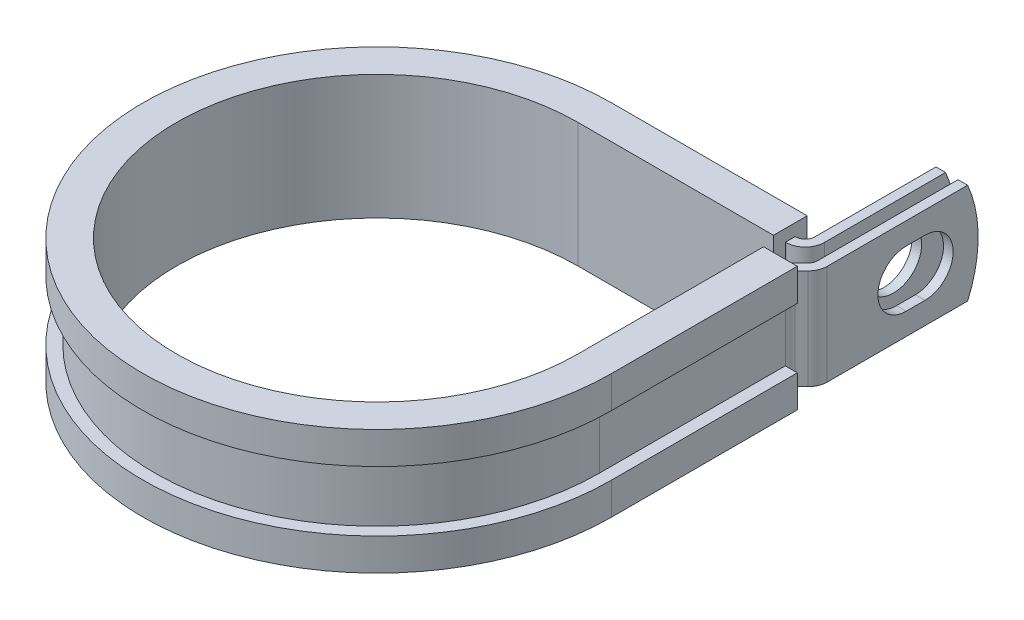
SolidWorks part; units mm, degrees
ref_plane "Front Plane" through (0, 0, 0) normal (0, 0, 1) x (1, 0, 0)
ref_plane "Top Plane" through (0, 0, 0) normal (0, 1, 0) x (1, 0, 0)
ref_plane "Right Plane" through (0, 0, 0) normal (1, 0, 0) x (0, 0, -1)
sketch "Sketch1" plane through (0, 0, 0) normal (0, 1, 0) x (1, 0, 0)
  line L0 (0, 26.924) -> (24.8083, 26.924)
  line L1 (26.924, 0) -> (26.924, 23.5115)
  line L2 (27.2467, 46.0248) -> (27.2467, 29.3624)
  line L3 (27.6382, 25.2357) -> (28.4644, 26.0619)
  line L5 (28.8215, 26.924) -> (28.8215, 46.0248)
  arc A0 (0, 26.924) -> (26.924, 0) centre (0, 0) ccw
  arc A1 (27.6382, 25.2357) -> (26.924, 23.5115) centre (29.3624, 23.5115) ccw
  arc A2 (28.4644, 26.0619) -> (28.8215, 26.924) centre (27.6023, 26.924) ccw
  arc A3 (24.8083, 26.924) -> (27.2467, 29.3624) centre (24.8083, 29.3624) ccw
extrude "Extrude-Thin1" add sketch "Sketch1" along normal mid plane 12.7 thin
sketch "Sketch2" plane through (26.0275, 0, 0) normal (-1, 0, 0) x (0, 0, 1)
  line L0 (-46.0248, 6.35) -> (-46.0248, -6.35) construction
  line L1 (0, 6.35) -> (0, -6.35) construction
  circle A0 centre (-38.1, 0) radius 3.5687
  point P2 (-46.0248, 0)
extrude "Cut-Extrude1" cut sketch "Sketch2" against normal up to surface (1.2192 mm away)
sketch "Sketch3" plane through (30.0407, 0, 0) normal (1, 0, 0) x (0, 0, -1)
  line L0 (36.9062, 0) -> (39.2938, 0) construction
  line L1 (36.9062, 3.5687) -> (39.2938, 3.5687)
  line L2 (36.9062, -3.5687) -> (39.2938, -3.5687)
  line L3 (46.0248, 6.35) -> (46.0248, -6.35) construction
  arc A0 (36.9062, 3.5687) -> (36.9062, -3.5687) centre (36.9062, 0) ccw
  arc A1 (39.2938, -3.5687) -> (39.2938, 3.5687) centre (39.2938, 0) ccw
  point P3 (38.1, 0)
  point P8 (46.0248, 0)
  point P11 (33.3375, 0)
  point P12 (42.8625, 0)
extrude "Cut-Extrude2" cut sketch "Sketch3" against normal up to surface (1.2192 mm away)
sketch "Sketch4" plane through (26.0275, 0, 0) normal (-1, 0, 0) x (0, 0, 1)
  line L0 (-46.0248, 6.35) -> (-46.0248, -6.35)
  line L1 (-46.0248, 6.35) -> (-44.6995, 6.35)
  line L2 (-46.0248, 6.35) -> (-29.3624, 6.35) construction
  line L3 (-46.0248, -6.35) -> (-44.6995, -6.35)
  line L4 (-46.0248, -6.35) -> (-29.3624, -6.35) construction
  arc A0 (-44.6995, 6.35) -> (-44.6995, -6.35) centre (-30.1498, 0) ccw
extrude "Cut-Extrude3" cut sketch "Sketch4" against normal through all contours A0 M4 M5 | A0 L0 M2
ref_plane "Plane1" through (0, 0, -23.5115) normal (0, 0, -1) x (-1, 0, 0)
ref_plane "Plane2" through (24.7575, 0, 0) normal (-1, 0, 0) x (0, 0, 1)
sketch "Sketch5" plane through (0, 0, -23.5115) normal (0, 0, -1) x (-1, 0, 0)
  line L0 (-28.1432, 6.35) -> (-26.924, 6.35)
  line L1 (-28.1432, 6.35) -> (-28.1432, -6.35) construction
  line L3 (-26.924, 6.35) -> (-26.924, -6.35)
  line L4 (-26.924, -6.35) -> (-28.1432, -6.35)
  line L5 (-28.1432, -6.35) -> (-28.1432, -3.81)
  line L6 (-28.1432, 6.35) -> (-28.1432, 3.81)
  line L7 (-29.6672, 7.874) -> (-29.6672, 3.81)
  line L8 (-29.6672, 7.874) -> (-25.4, 7.874)
  line L9 (-25.4, 7.874) -> (-25.4, -7.874)
  line L10 (-25.4, -7.874) -> (-29.6672, -7.874)
  line L11 (-29.6672, -7.874) -> (-29.6672, -3.81)
  line L12 (-29.6672, 3.81) -> (-28.1432, 3.81)
  line L13 (-28.1432, -3.81) -> (-29.6672, -3.81)
sketch "Sketch6" plane through (0, 6.35, 0) normal (0, 1, 0) x (1, 0, 0)
  line L0 (25.4, 0) -> (25.4, 23.5115)
  line L1 (25.4, 23.5115) -> (29.6672, 23.5115) construction
  line L2 (24.7575, 6.9878) -> (24.7575, -6.9878) construction
  line L5 (0, 25.4) -> (24.7575, 25.4)
  arc A0 (0, 25.4) -> (25.4, 0) centre (0, 0) ccw
sweep "Sweep1" add profiles "Sketch5" path "Sketch6"
equation "\"D4@Sketch5\" = \"D1@Extrude-Thin1\""
equation "\"D5@Sketch5\" = \"D5@Extrude-Thin1\""
equation "\"D1@Sketch3\" = \"D2@Sketch2\""
equation "\"D7@Sketch1\" = \"D3@Sketch2\" + \"D1@Sketch3\""
equation "\"D1@Sketch1\" = \"D1@Sketch6\" + 2 * \"D3@Sketch5\""
equation "\"D1@Sketch4\" = ( \"D1@Extrude-Thin1\" + .125 ) * 2"
equation "\"D9@Sketch1\"= \"D5@Extrude-Thin1\""
equation "\"D8@Sketch1\"= 2 * \"D5@Extrude-Thin1\""
equation "\"D2@Sketch1\" = 2 * \"D5@Extrude-Thin1\""
equation "\"D2@Sketch3\" = \"D1@Sketch2\""
